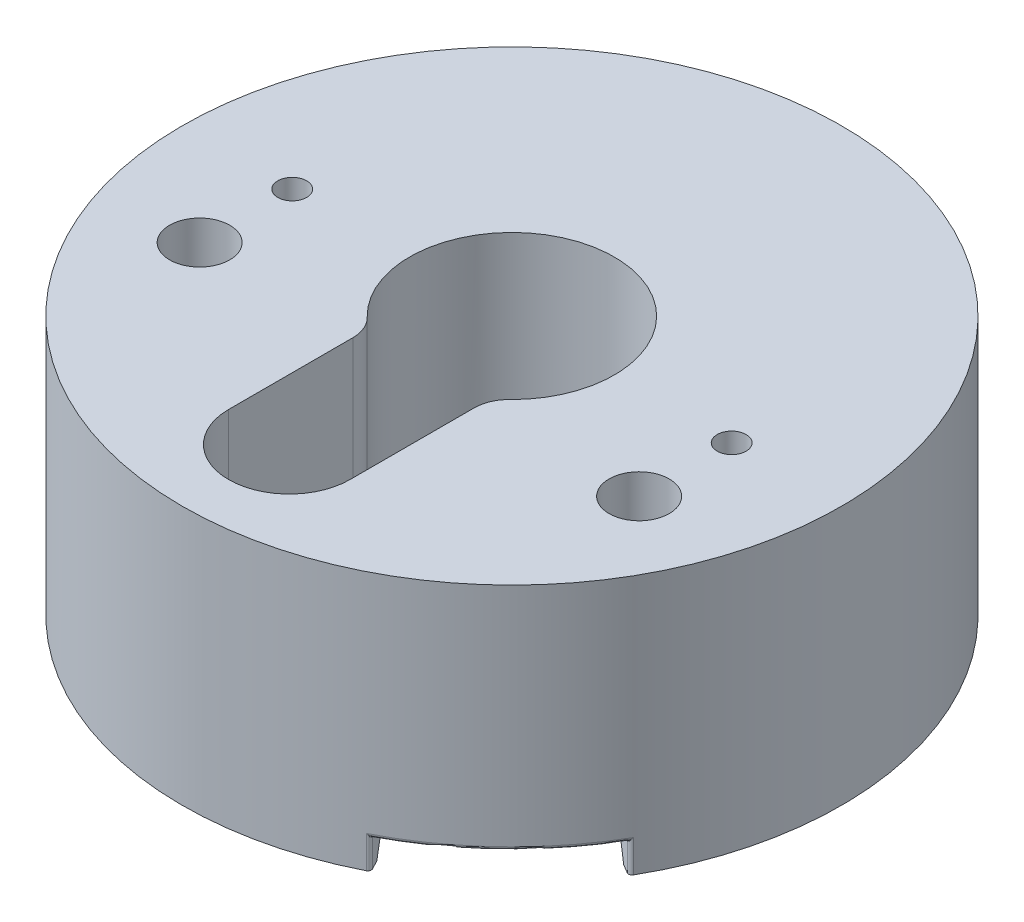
SolidWorks part; units mm, degrees
ref_plane "XY - Vorne" through (0, 0, 0) normal (0, 0, 1) x (1, 0, 0)
ref_plane "XZ - Oben" through (0, 0, 0) normal (0, 1, 0) x (1, 0, 0)
ref_plane "YZ - Rechts" through (0, 0, 0) normal (1, 0, 0) x (0, 0, -1)
sketch "Skizze1" plane through (0, 0, 0) normal (0, 1, 0) x (1, 0, 0)
  circle A0 centre (0, 0) radius 28.5
  dimension "D1" = 57
extrude "Aufsatz-Linear austragen1" add sketch "Skizze1" along normal blind 22.4
sketch "Skizze2" plane through (0, 0, 0) normal (0, -1, 0) x (1, 0, 0)
  circle A0 centre (0, 0) radius 27.325
  circle A1 centre (0, 0) radius 28.5 construction
  dimension "D1" = 54.65
extrude "Schnitt-Linear austragen1" cut sketch "Skizze2" against normal blind 2.5 draft 27
sketch "Skizze3" plane through (0, 22.4, 0) normal (0, 1, 0) x (1, 0, 0)
  circle A0 centre (0, 0) radius 25.35
  circle A1 centre (0, 0) radius 28.5 construction
  dimension "D1" = 50.7
extrude "Schnitt-Linear austragen2" [suppressed] cut sketch "Skizze3" against normal blind 2
sketch "Skizze4" plane through (0, 2.5, 0) normal (0, -1, 0) x (-1, 0, 0)
  line L0 (-19, 0) -> (19, 0) construction
  line L2 (0, 0) -> (0, -1.9579) construction
  point P0 (-19, 0)
  point P2 (19, 0)
  dimension "D1" = 38
hole_wizard "Ø2.5 (2.5) Durchmesser Bohrung1" positions "Skizze4" profile "Skizze5" hole size "Ø2.5" standard "DIN"
sketch "Skizze5" plane through (19, 2.5, 0) normal (1, 0, 0) x (0, 0, -1)
  line L0 (0, 0) -> (0, 19.9)
  line L1 (0, 19.9) -> (1.25, 19.9)
  line L2 (1.25, 19.9) -> (1.25, 0.15)
  line L3 (1.25, 0.15) -> (1.4, 0)
  line L5 (1.4, 0) -> (0, 0)
  line L6 (-1.25, 0.15) -> (-1.4, 0) construction
  line L11 (0, -6.35) -> (0, 107.95) construction
  dimension "Bohrerdurchmesser" = 2.5
  dimension "Bohrungstiefe" = 19.9
  dimension "Senkdurchmesser2 (Oben)" = 2.8
  dimension "Senkwinkel2 (Oben)" = 90
sketch "Skizze6" plane through (0, 22.4, 0) normal (0, 1, 0) x (1, 0, 0)
  line L0 (-5.25, -7.1246) -> (-5.25, -19.25)
  line L1 (5.25, -7.1246) -> (5.25, -19.25)
  line L2 (-5.25, -7.1246) -> (5.25, -7.1246) construction
  line L3 (-19, 0) -> (19, 0) construction
  line L4 (0, -7.1246) -> (0, 0) construction
  arc A0 (5.25, -7.1246) -> (-5.25, -7.1246) centre (0, 0) ccw
  arc A2 (-5.25, -19.25) -> (5.25, -19.25) centre (0, -19.25) ccw
  circle A3 centre (0, 0) radius 28.5 construction
  point P14 (0, -24.5)
  dimension "D1" = 17.7
  dimension "D2" = 10.5
  dimension "D3" = 24.5
extrude "Schnitt-Linear austragen3" cut sketch "Skizze6" against normal blind 14
sketch "Skizze7" plane through (0, 8.4, 0) normal (0, 1, 0) x (1, 0, 0)
  circle A0 centre (0, 0) radius 8.85
  arc A1 (5.25, -7.1246) -> (-5.25, -7.1246) centre (0, 0) ccw construction
extrude "Schnitt-Linear austragen4" cut sketch "Skizze7" against normal through all
sketch "Skizze9" plane through (0, 2.5, 0) normal (0, -1, 0) x (-1, 0, 0)
  line L0 (0, 0) -> (-19, 0) construction
  line L2 (0, 0) -> (0, -12.6036) construction
  circle A0 centre (0, 0) radius 8.85 construction
  point P0 (-19, -8)
  point P2 (19, -8)
  dimension "D1" = 38
  dimension "D2" = 8
hole_wizard "Formsenkung für M5 Senkschraube mit Schlitz/Kreuzschlitz1" positions "Skizze9" profile "Skizze10" countersink size "M5" standard "DIN"
sketch "Skizze10" plane through (19, 2.5, 8) normal (1, 0, 0) x (0, 0, -1)
  line L0 (0, 0) -> (0, 19.9)
  line L1 (0, 19.9) -> (2.6, 19.9)
  line L2 (2.6, 19.9) -> (2.6, 12.1)
  line L3 (2.6, 12.1) -> (4.7, 10)
  line L4 (4.7, 10) -> (4.7, 0)
  line L6 (4.7, 0) -> (0, 0)
  line L7 (-2.6, 12.1) -> (-4.7, 10) construction
  line L11 (0, -6.35) -> (0, 107.95) construction
  dimension "Bohrerdurchmesser" = 5.2
  dimension "Bohrungstiefe" = 19.9
  dimension "Senkdurchmesser" = 9.4
  dimension "Senkwinkel" = 90
  dimension "Kopfspielraum" = 10
sketch "Skizze8" plane through (0, 2.5, 0) normal (0, -1, 0) x (1, 0, 0)
  line L0 (0, 0) -> (20.0147, 16.6756) construction
  line L1 (0, 0) -> (26.0512, 0) construction
  line L2 (0, 0) -> (22.4438, 13.2265) construction
  line L3 (22.4438, 13.2265) -> (24.5535, 14.4698)
  line L4 (0, 0) -> (17.0608, 19.6874) construction
  line L5 (17.0608, 19.6874) -> (18.6645, 21.538) construction
  line L6 (24.5535, 14.4698) -> (18.6645, 21.538) construction
  line L7 (20.0147, 16.6756) -> (21.609, 18.0039) construction
  line L8 (21.609, 18.0039) -> (21.8961, 18.2431) construction
  line L9 (21.8961, 18.2431) -> (13.1157, 25.3027) construction
  line L10 (13.1157, 25.3027) -> (11.9888, 23.1286)
  line L11 (0, 0) -> (11.9888, 23.1286) construction
  circle A0 centre (0, 0) radius 26.0512 construction
  circle A4 centre (0, 0) radius 28.5 construction
  arc A5 (24.5535, 14.4698) -> (13.1157, 25.3027) centre (0, 0) ccw
  arc A6 (22.4438, 13.2265) -> (11.9888, 23.1286) centre (0, 0) ccw
  point P4 (21.609, 18.0039)
  dimension "D1" = 39.8
  dimension "D2" = 9.2
  dimension "D4" = 62.6
extrude "Schnitt-Linear austragen5" cut sketch "Skizze8" along normal up to surface (2.5 mm away)
fillet "Verrundung1" radius 3 2 edges at (-5.25, 15.4, 7.1246) (5.25, 15.4, 7.1246)
fillet "Verrundung2" radius 1 1 edges at (0, 2.5, -8.85)
fillet "Verrundung3" radius 0.4 2 edges at (-19, 2.5, 3.3) (19, 2.5, 3.3)
fillet "Verrundung4" radius 0.4 1 edges at (19, 14.6, 5.4)
fillet "Verrundung5" radius 0.3 3 edges at (13.1157, 1.25, 25.3027) (24.5535, 1.25, 14.4698) (19.598, 2.5, 20.6923)
fillet "Verrundung6" radius 0.1 6 edges at (13.0103, 2.5386, 25.1853) (12.9773, 2.5, 25.0357) (24.442, 2.5386, 14.3582) (24.2943, 2.5, 14.3171) (12.4828, 2.5, 24.0818) (23.3687, 2.5, 13.7716)
